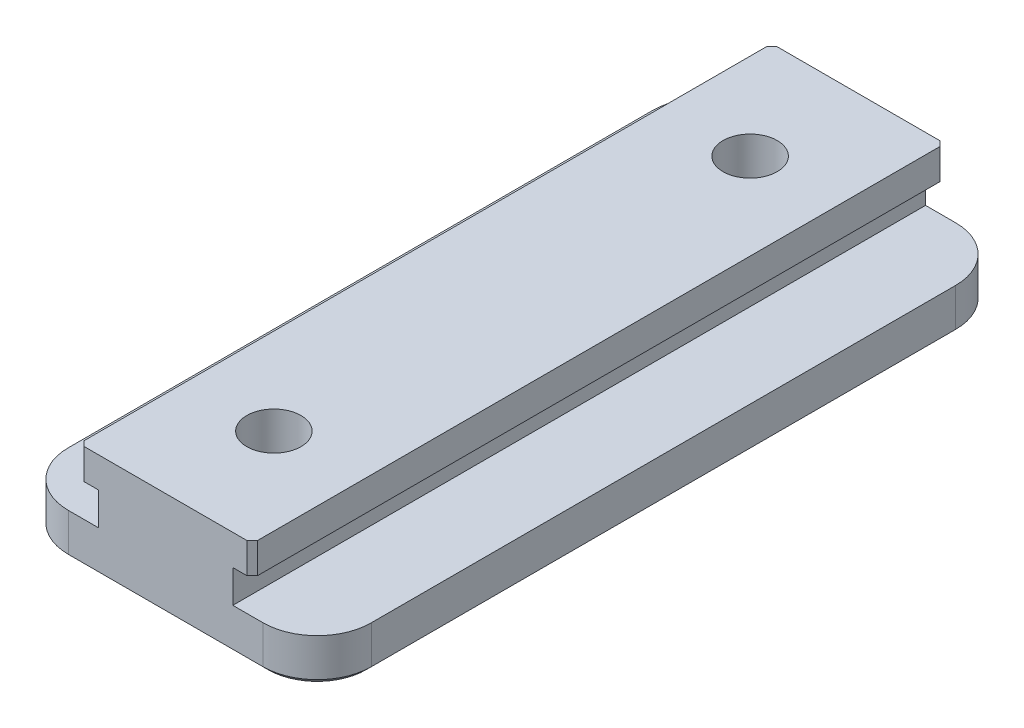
SolidWorks part; units mm, degrees
ref_plane "Front Plane" through (0, 0, 0) normal (0, 0, 1) x (1, 0, 0)
ref_plane "Top Plane" through (0, 0, 0) normal (0, 1, 0) x (1, 0, 0)
ref_plane "Right Plane" through (0, 0, 0) normal (1, 0, 0) x (0, 0, -1)
sketch "Sketch1" plane through (0, 0, 0) normal (0, 0, 1) x (1, 0, 0)
  line L0 (0, 0) -> (0, 6.3312) construction
  line L1 (12.7, 6.096) -> (-12.7, 6.096)
  line L2 (-12.7, 6.096) -> (-12.7, 1.6256)
  line L3 (-12.7, 1.6256) -> (-9.8552, 1.6256)
  line L4 (-9.8552, 1.6256) -> (-9.8552, -3.175)
  line L5 (-9.8552, -3.175) -> (-22.225, -3.175)
  line L6 (-22.225, -3.175) -> (-22.225, -9.525)
  line L7 (-22.225, -9.525) -> (22.225, -9.525)
  line L9 (22.225, -3.175) -> (22.225, -9.525)
  line L10 (9.8552, -3.175) -> (22.225, -3.175)
  line L11 (9.8552, 1.6256) -> (9.8552, -3.175)
  line L12 (12.7, 1.6256) -> (9.8552, 1.6256)
  line L13 (12.7, 6.096) -> (12.7, 1.6256)
  point P13 (0, -9.525)
  point P18 (0, 6.096)
  dimension "D1" = 25.4
  dimension "D2" = 44.45
  dimension "D3" = 6.35
  dimension "D4" = 15.621
  dimension "D5" = 4.8006
  dimension "D6" = 19.7104
  dimension "D7" = 6.096
extrude "Boss-Extrude1" add sketch "Sketch1" along normal mid plane 101.6
fillet "Fillet1" radius 7.9502 4 edges at (-22.225, -6.35, 50.8) (-22.225, -6.35, -50.8) (22.225, -6.35, -50.8) (22.225, -6.35, 50.8)
chamfer "Chamfer1" distance 0.762 angle 45 8 edges at (0, -9.525, -50.8) (-19.8964, -9.525, -48.4714) (19.8964, -9.525, -48.4714) (-22.225, -9.525, 0) (22.225, -9.525, 0) (-19.8964, -9.525, 48.4714) (19.8964, -9.525, 48.4714) (0, -9.525, 50.8)
chamfer "Chamfer3" distance 0.762 angle 45 4 edges at (12.7, 3.8608, -50.8) (-12.7, 3.8608, -50.8) (-12.7, 3.8608, 50.8) (12.7, 3.8608, 50.8)
hole_wizard " Tapped Hole1" positions "Sketch2" profile "Sketch4" tap size "3/8-16" standard "ANSI Inch"
sketch "Sketch2" plane through (0, -9.525, 0) normal (0, -1, 0) x (-1, 0, 0)
  line L0 (6.1406, 0) -> (-5.5042, 0) construction
  point P0 (0, 34.925)
  dimension "TS" = 34.925
sketch "Sketch4" plane through (0, -9.525, -34.925) normal (1, 0, 0) x (0, 0, -1)
  line L0 (0, 0) -> (0, 15.621)
  line L1 (0, 15.621) -> (3.9687, 15.621)
  line L2 (3.9687, 15.621) -> (3.9687, 0)
  line L5 (3.9687, 0) -> (0, 0)
  line L11 (0, -6.35) -> (0, 107.95) construction
  dimension "Thru Tap Drill Dia." = 7.9375
  dimension "Thru Tap Drill Depth" = 15.621
mirror "Mirror1" about plane through (0, 0, 0) normal (0, 0, 1) of " Tapped Hole1"
